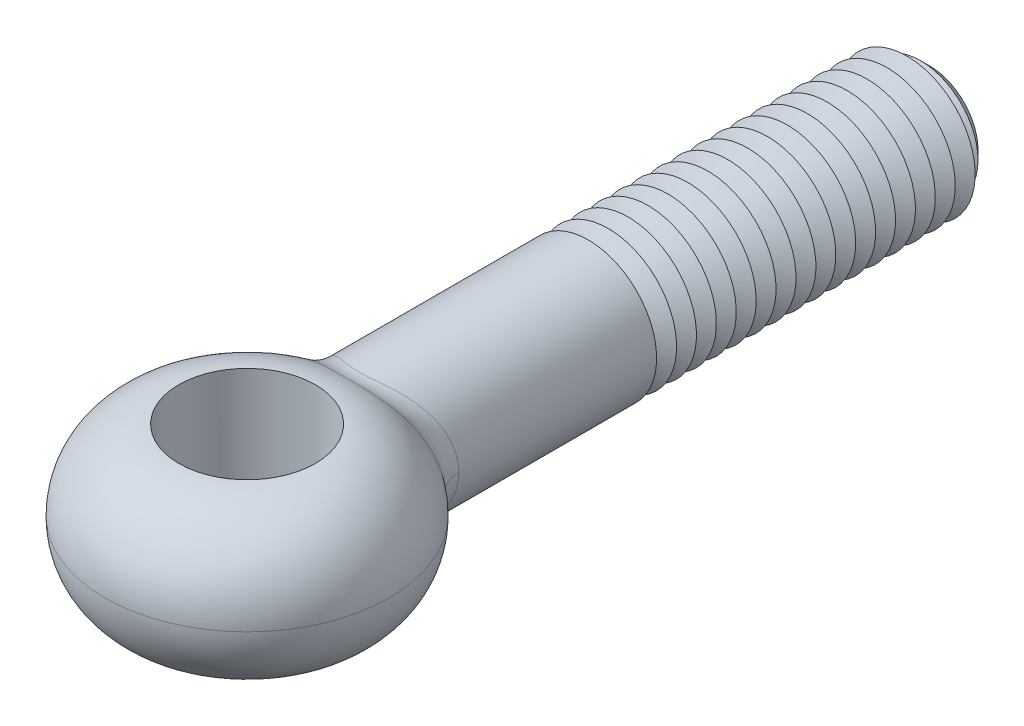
SolidWorks part; units mm, degrees
ref_plane "Front Plane" through (0, 0, 0) normal (0, 0, 1) x (1, 0, 0)
ref_plane "Top Plane" through (0, 0, 0) normal (0, 1, 0) x (1, 0, 0)
ref_plane "Right Plane" through (0, 0, 0) normal (1, 0, 0) x (0, 0, -1)
sketch "Sketch7" plane through (0, 0, 0) normal (0, 1, 0) x (1, 0, 0)
  circle A0 centre (0, 0) radius 12.5
  dimension "D1" = 25
extrude "Boss-Extrude3" add sketch "Sketch7" along normal mid plane 14
sketch "Sketch8" plane through (0, 0, 0) normal (0, 0, 1) x (1, 0, 0)
  circle A0 centre (0, 0) radius 6
  dimension "D1" = 12
extrude "Boss-Extrude4" add sketch "Sketch8" against normal blind 60
fillet "Fillet5" radius 7 2 edges at (0, -7, 12.5) (0, 7, 12.5)
fillet "Fillet6" radius 3 2 edges at (0.1735, -5.9975, -9.1081) (-0.1735, 5.9975, -9.1081)
chamfer "Chamfer1" distance 1.75 angle 45 1 edges at (6, 0, -60)
sketch "Sketch10" plane through (0, 0, 0) normal (0, 1, 0) x (1, 0, 0)
  line L0 (0, 28.1405) -> (0, -7.9233) construction
sketch "Sketch11" plane through (0, 0, 0) normal (0, 1, 0) x (1, 0, 0)
  line L0 (-6, 30) -> (-4.4845, 30.875)
  line L1 (-6, 58.25) -> (-6, 12.6194) construction
  line L2 (-4.4845, 30.875) -> (-6, 31.75)
  line L3 (-6, 31.75) -> (-6, 30)
  line L4 (4.25, 60) -> (-4.25, 60) construction
  dimension "D1" = 1.75
  dimension "D2" = 30
revolve "Cut-Revolve1" cut sketch "Sketch11" angle 360 about L0
pattern_linear "LPattern1" count 17 spacing 1.75 along (0, 0, -1) of "Cut-Revolve1"
sketch "Sketch12" plane through (0, 0, 0) normal (0, 1, 0) x (1, 0, 0)
  circle A0 centre (0, 0) radius 6
  dimension "D1" = 12
extrude "Cut-Extrude1" cut sketch "Sketch12" against normal mid plane 14
